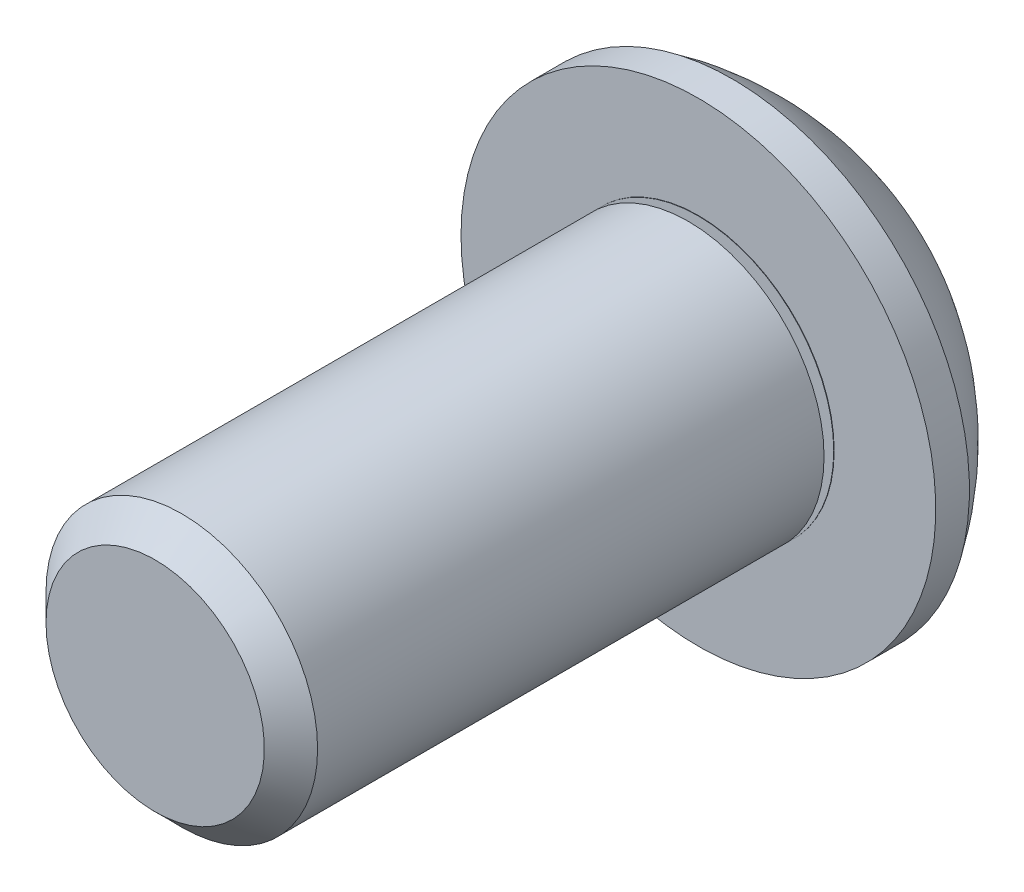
SolidWorks part; units mm, degrees
ref_plane "Front" through (0, 0, 0) normal (0, 0, 1) x (1, 0, 0)
ref_plane "Top" through (0, 0, 0) normal (0, 1, 0) x (1, 0, 0)
ref_plane "Right" through (0, 0, 0) normal (1, 0, 0) x (0, 0, -1)
sketch "Logo3_Revol_Axis" plane through (0, 0, 0) normal (0, 1, 0) x (1, 0, 0)
  line L0 (0, -43.5172) -> (0, 43.5172) construction
sketch "Logo3_bib1" plane through (0, 0, 0) normal (0, -1, 0) x (-1, 0, 0)
  line L0 (0, -12.7) -> (0, 3.3528)
  line L1 (0, 3.3528) -> (2.4765, 3.3528)
  line L2 (5.5499, 0.7874) -> (5.5499, 0)
  line L3 (5.5499, 0) -> (3.175, 0)
  line L4 (3.175, 0) -> (3.175, -0.01)
  line L5 (3.175, -12.0777) -> (2.5527, -12.7)
  line L6 (2.5527, -12.7) -> (0, -12.7)
  line L7 (3.175, -0.01) -> (2.6661, -0.01)
  line L8 (2.6593, -0.0488) -> (3.175, -0.2365)
  line L9 (3.175, -0.2365) -> (3.175, -12.0777)
  line L10 (0, 10.5852) -> (0, -63.2873) construction
  arc A1 (2.6661, -0.01) -> (2.6593, -0.0488) centre (2.6661, -0.03) ccw
  arc A2 (5.5499, 0.7874) -> (2.4765, 3.3528) centre (-0.1901, -2.9655) ccw
  point P17 (2.5527, -0.01)
revolve "Revolve1" add sketch "Logo3_bib1" angle 360 about L10
sketch "Logo3_bib2" plane through (0, 0, -3.3528) normal (0, 0, -1) x (1, 0, 0)
  line L1 (2.2877, 0) -> (1.1438, 1.9812)
  line L2 (1.1438, 1.9812) -> (-1.1438, 1.9812)
  line L3 (-1.1438, 1.9812) -> (-2.2877, 0)
  line L4 (-2.2877, 0) -> (-1.1438, -1.9812)
  line L5 (-1.1438, -1.9812) -> (1.1438, -1.9812)
  line L6 (1.1438, -1.9812) -> (2.2877, 0)
  circle A0 centre (0, 0) radius 1.9812 construction
  dimension "Logo3_c1" = 3.9624
extrude "Cut-Extrude1" cut sketch "Logo3_bib2" against normal blind 2.2098
equation "\"DIA2@Logo3_bib1\" = \"Logo3_d1-pas@Logo3_bib1\""
equation "\"D2@Cosmetic Thread1\" = \"Logo3_d1-pas@Logo3_bib1\""
